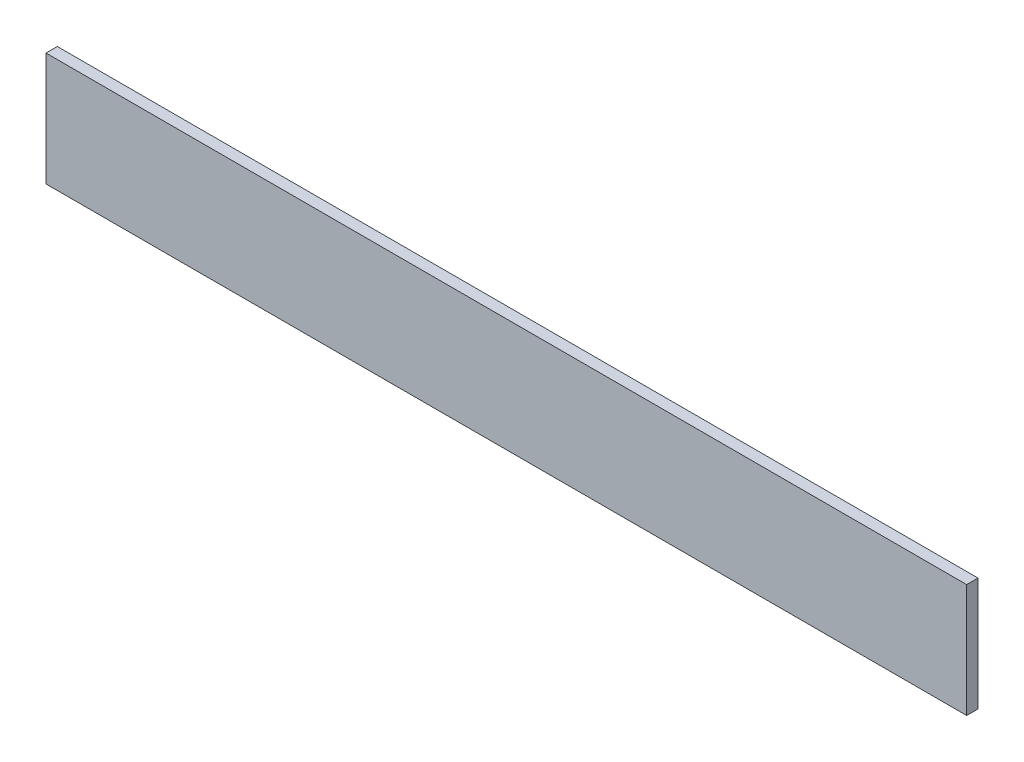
SolidWorks part; units mm, degrees
ref_plane "Plan de face" through (0, 0, 0) normal (0, 0, 1) x (1, 0, 0)
ref_plane "Plan de dessus" through (0, 0, 0) normal (0, 1, 0) x (1, 0, 0)
ref_plane "Plan de droite" through (0, 0, 0) normal (1, 0, 0) x (0, 0, -1)
sketch "Esquisse1" plane through (0, 0, 0) normal (0, 0, 1) x (1, 0, 0)
  line L1 (0, 0) -> (812, 0)
  line L2 (0, 0) -> (0, -100)
  line L3 (0, -100) -> (812, -100)
  line L4 (812, 0) -> (812, -100)
  dimension "D1" = 812
  dimension "D2" = 100
extrude "Extrusion1" add sketch "Esquisse1" along normal blind 10
